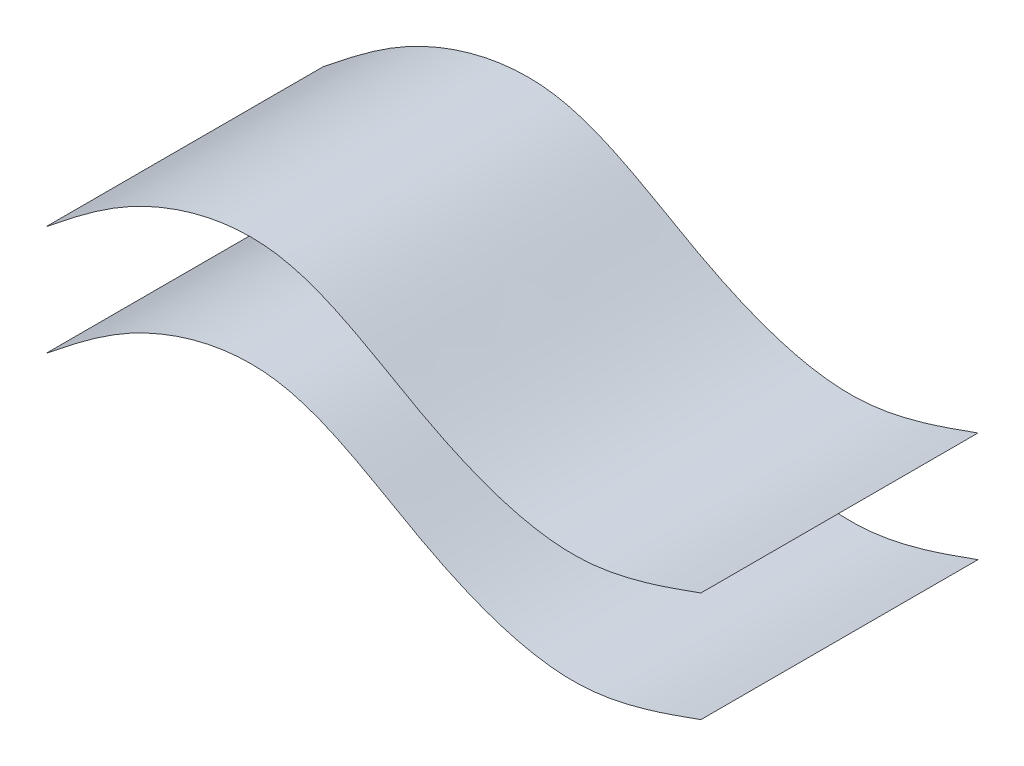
SolidWorks part; units mm, degrees
ref_plane "Front Plane" through (0, 0, 0) normal (0, 0, 1) x (1, 0, 0)
ref_plane "Top Plane" through (0, 0, 0) normal (0, 1, 0) x (1, 0, 0)
ref_plane "Right Plane" through (0, 0, 0) normal (1, 0, 0) x (0, 0, -1)
sketch "Sketch1" plane through (0, 0, 0) normal (0, 0, 1) x (1, 0, 0)
  spline S0 degree 3 poles (-78.3903, 0) (-68.8503, 7.6461) (-45.2539, 26.5578) (8.4943, 42.2877) (58.3114, 7.1276) (112.8402, -13.7726) (146.912, -1.5441) (161.68, 3.7562) knots 0 0 0 0 0.143381 0.354639 0.58938 0.822021 1 1 1 1
surface "Surface-Extrude1" sketch "Sketch1" parameters "D1"=101.6
move or copy body "Body-Move/Copy1" bodies to move or copy 101
